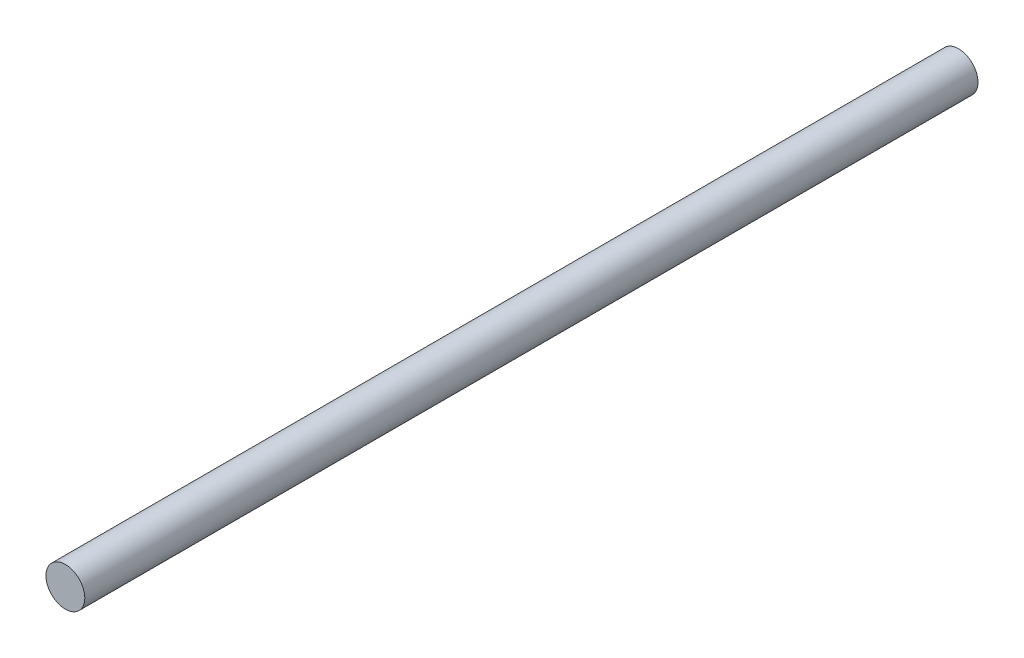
SolidWorks part; units mm, degrees
ref_plane "Plan de face" through (0, 0, 0) normal (0, 0, 1) x (1, 0, 0)
ref_plane "Plan de dessus" through (0, 0, 0) normal (0, 1, 0) x (1, 0, 0)
ref_plane "Plan de droite" through (0, 0, 0) normal (1, 0, 0) x (0, 0, -1)
sketch "Esquisse1" plane through (0, 0, 0) normal (0, 0, 1) x (1, 0, 0)
  circle A0 centre (0, 0) radius 1.5
  dimension "D1" = 3
extrude "Boss.-Extru.1" add sketch "Esquisse1" along normal blind 69
